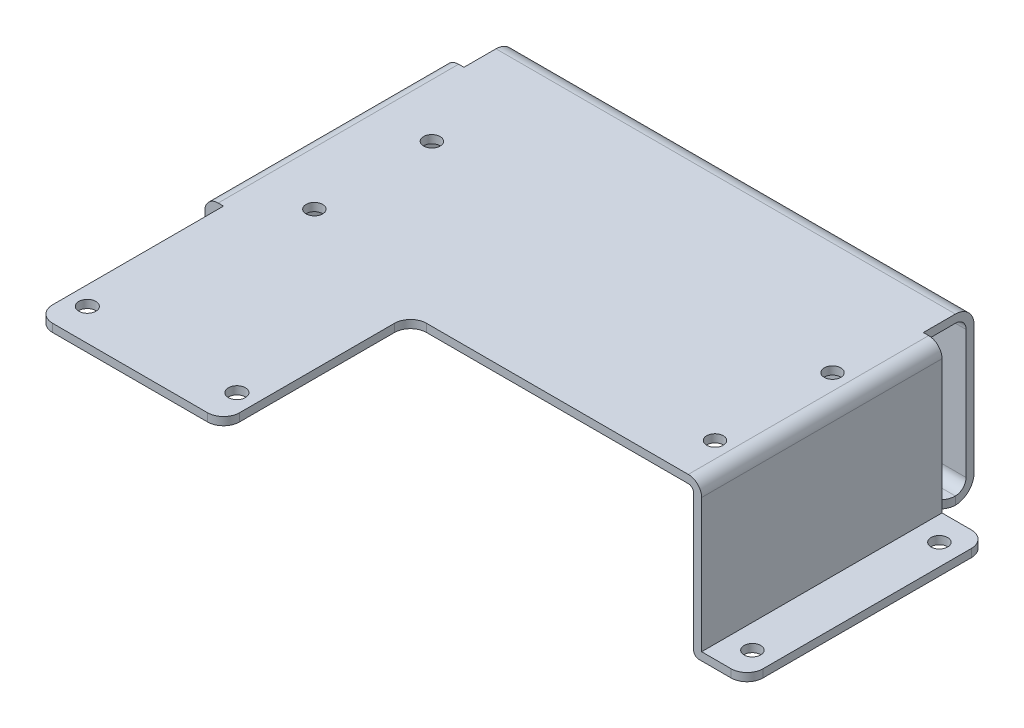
SolidWorks part; units mm, degrees
ref_plane "前视基准面" through (0, 0, 0) normal (0, 0, 1) x (1, 0, 0)
ref_plane "上视基准面" through (0, 0, 0) normal (0, 1, 0) x (1, 0, 0)
ref_plane "右视基准面" through (0, 0, 0) normal (1, 0, 0) x (0, 0, -1)
sketch "草图1" plane through (0, 0, 0) normal (0, 0, 1) x (1, 0, 0)
  line L0 (-44, 27.5) -> (44, 27.5)
  line L1 (45, 26.5) -> (45, 1)
  line L2 (46, 0) -> (55, 0)
  line L3 (0, 0) -> (0, 34.5093) construction
  line L4 (-46, 0) -> (-55, 0)
  line L5 (-45, 26.5) -> (-45, 1)
  arc A0 (45, 1) -> (46, 0) centre (46, 1) ccw
  arc A1 (44, 27.5) -> (45, 26.5) centre (44, 26.5) cw
  arc A2 (-44, 27.5) -> (-45, 26.5) centre (-44, 26.5) ccw
  arc A3 (-45, 1) -> (-46, 0) centre (-46, 1) cw
  point P9 (45, 0)
  point P12 (45, 27.5)
  point P20 (0, 27.5)
  dimension "D4" = 1
  dimension "D1" = 45
  dimension "D2" = 27.5
  dimension "D3" = 10
extrude "拉伸-薄壁1" add sketch "草图1" along normal mid plane 45 thin
sketch "草图3" plane through (0, 29, 0) normal (0, 1, 0) x (1, 0, 0)
  line L0 (0, 0) -> (0, 35.8899) construction
  line L1 (0, 0) -> (-66.9739, 0) construction
  line L2 (44, 22.5) -> (-44, 22.5) construction
  line L3 (-46.5, 22.5) -> (-55, 22.5) construction
  circle A0 centre (-34, 7.5) radius 1.55
  circle A1 centre (41, 7.5) radius 1.55
  circle A2 centre (41, -14.5) radius 1.55
  circle A3 centre (-34, -14.5) radius 1.55
  circle A4 centre (-51, 17.5) radius 1.55
  circle A5 centre (51, 17.5) radius 1.55
  circle A6 centre (-51, -17.5) radius 1.55
  circle A7 centre (51, -17.5) radius 1.55
  dimension "D1" = 3.1
  dimension "D2" = 34
  dimension "D3" = 15
  dimension "D4" = 2
  dimension "D6" = 5
  dimension "D7" = 3.1
  dimension "D8" = 51
  dimension "D5" = 2
extrude "切除-拉伸1" cut sketch "草图3" against normal blind 45
sketch "草图4" plane through (0, 0, 0) normal (1, 0, 0) x (0, 0, -1)
  line L0 (22.5, 27.5) -> (28.5, 27.5)
  line L1 (30.5, 25.5) -> (30.5, 1.5)
  line L2 (28.5, -0.5) -> (25.5, -0.5)
  arc A0 (30.5, 1.5) -> (28.5, -0.5) centre (28.5, 1.5) cw
  arc A1 (28.5, 27.5) -> (30.5, 25.5) centre (28.5, 25.5) cw
  point P7 (30.5, -0.5)
  point P10 (30.5, 27.5)
  dimension "D4" = 2
  dimension "D1" = 8
  dimension "D2" = 28
  dimension "D3" = 5
extrude "拉伸-薄壁2" add sketch "草图4" along normal mid plane 86 thin
sketch "草图7" plane through (0, 0, 22.5) normal (0, 0, 1) x (1, 0, 0)
  line L0 (44, 29) -> (-44, 29) construction
  line L1 (-43, 29) -> (-8, 29)
  line L2 (-43, 29) -> (-43, 27.5)
  line L3 (-43, 27.5) -> (-8, 27.5)
  line L4 (-8, 29) -> (-8, 27.5)
  line L5 (43, 27.5) -> (-43, 27.5) construction
  line L6 (-43, 25.5) -> (-43, 1.5) construction
  dimension "D1" = 0
  dimension "D2" = 35
extrude "凸台-拉伸1" add sketch "草图7" along normal blind 35
sketch "草图8" plane through (0, 29, 0) normal (0, 1, 0) x (1, 0, 0)
  line L0 (-62.4434, -51.5) -> (24.0234, -51.5) construction
  line L1 (-25.5, -57.5) -> (-25.5, -24.1192) construction
  line L2 (-8, -57.5) -> (-43, -57.5) construction
  circle A0 centre (-39.5, -51.5) radius 1.6
  circle A1 centre (-11.5, -51.5) radius 1.6
  dimension "D1" = 3.2
  dimension "D2" = 3.2
  dimension "D3" = 14
  dimension "D4" = 14
  dimension "D5" = 6
extrude "切除-拉伸3" cut sketch "草图8" against normal blind 15
fillet "圆角1" radius 3 8 edges at (43, -1.25, -25.5) (55, 0.75, -22.5) (55, 0.75, 22.5) (-43, -1.25, -25.5) (-55, 0.75, -22.5) (-55, 0.75, 22.5) (-8, 28.25, 57.5) (-43, 28.25, 57.5)
fillet "圆角2" radius 3 1 edges at (-8, 28.25, 22.5)
